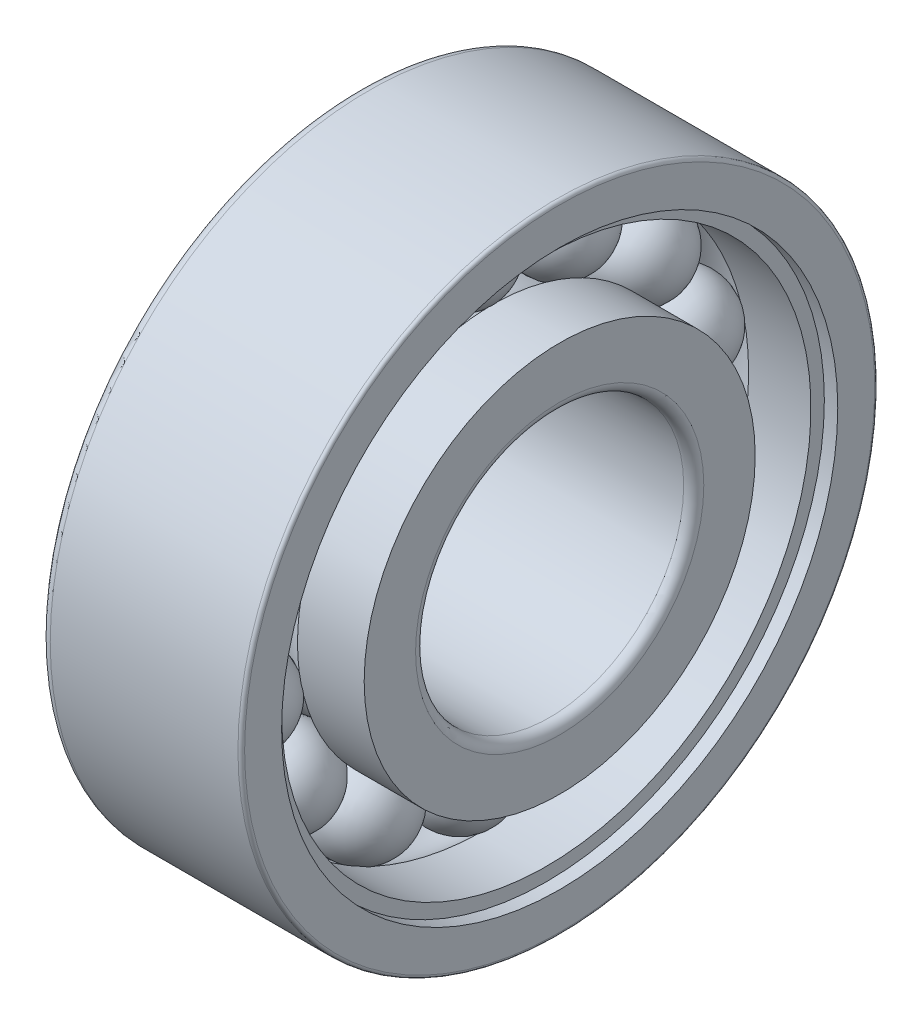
SolidWorks part; units mm, degrees
other "<angular contact ball bearings gb>-<Fillet2>"
ref_plane "前视基准面" through (0, 0, 0) normal (0, 0, 1) x (1, 0, 0)
ref_plane "上视基准面" through (0, 0, 0) normal (0, 1, 0) x (1, 0, 0)
ref_plane "右视基准面" through (0, 0, 0) normal (1, 0, 0) x (0, 0, -1)
other "Configuration Table"
inserted part "angular contact ball bearings gb"
